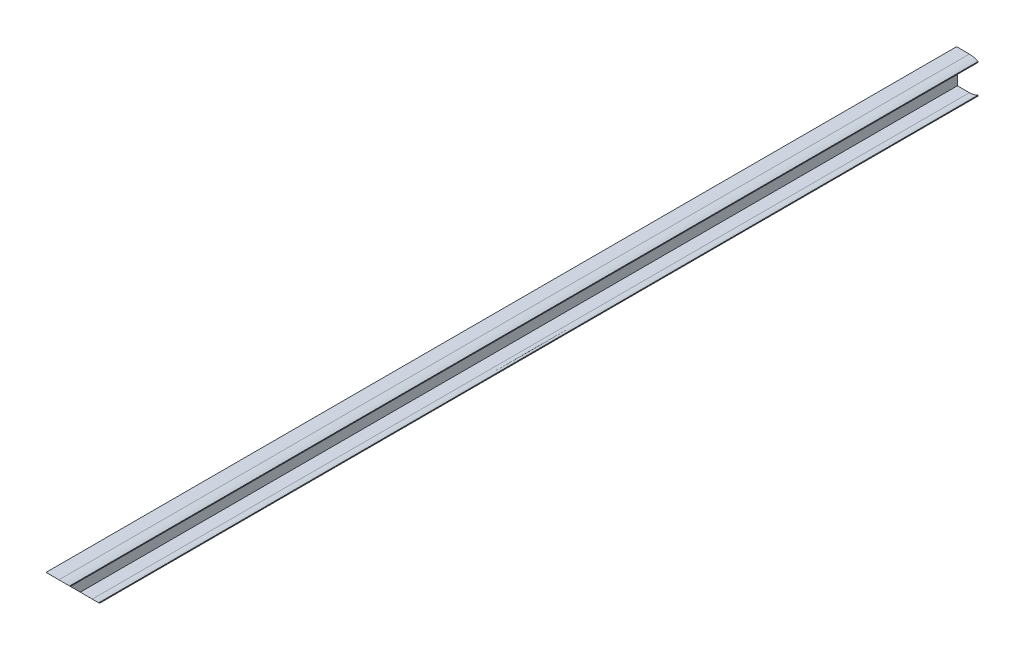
SolidWorks part; units mm, degrees
ref_plane "Plan de face" through (0, 0, 0) normal (0, 0, 1) x (1, 0, 0)
ref_plane "Plan de dessus" through (0, 0, 0) normal (0, 1, 0) x (1, 0, 0)
ref_plane "Plan de droite" through (0, 0, 0) normal (1, 0, 0) x (0, 0, -1)
sketch "Esquisse1" plane through (0, 0, 0) normal (0, 0, 1) x (1, 0, 0)
  line L0 (0, 0) -> (0, 80)
  line L1 (0, 80) -> (30, 80)
  line L2 (0, 40) -> (81.0721, 40) construction
  line L3 (2, 78) -> (2, 2)
  line L4 (0, 0) -> (30, 0)
  line L5 (2, 78) -> (30, 78)
  line L6 (50, 75) -> (50, 73)
  line L7 (50, 5) -> (50, 7)
  line L8 (2, 2) -> (30, 2)
  spline S0 degree 2 poles (30, 80) (40.6033, 79.9515) (50, 75) knots 0 0 0 1 1 1
  spline S1 degree 2 poles (30, 0) (40.6033, 0.0485) (50, 5) knots 0 0 0 1 1 1
  spline S2 degree 2 poles (30, 78) (40.6033, 77.9515) (50, 73) knots 0 0 0 1 1 1
  spline S3 degree 2 poles (30, 2) (40.6033, 2.0485) (50, 7) knots 0 0 0 1 1 1
  point P20 (2, 40)
  dimension "D1" = 80
  dimension "D2" = 30
  dimension "D3" = 5
  dimension "D4" = 50
  dimension "D5" = 1.2
  dimension "D6" = 10
  dimension "D7" = 5
  dimension "D8" = 10
  dimension "D9" = 1.2
  dimension "D10" = 28
  dimension "D11" = 20
  dimension "D12" = 2
  dimension "D13" = 2
extrude "Extrusion1" add sketch "Esquisse1" along normal blind 2125
sketch "Esquisse4" plane through (0, 0, 0) normal (-1, 0, 0) x (0, 0, 1)
  line L0 (2125, 80) -> (2045, 0)
  line L1 (2125, 0) -> (0, 0) construction
  line L3 (2125, 0) -> (2125, 80)
  line L4 (2045, 0) -> (2125, 0)
  dimension "D1" = 45
extrude "Extrusion5" cut sketch "Esquisse4" against normal up to next
